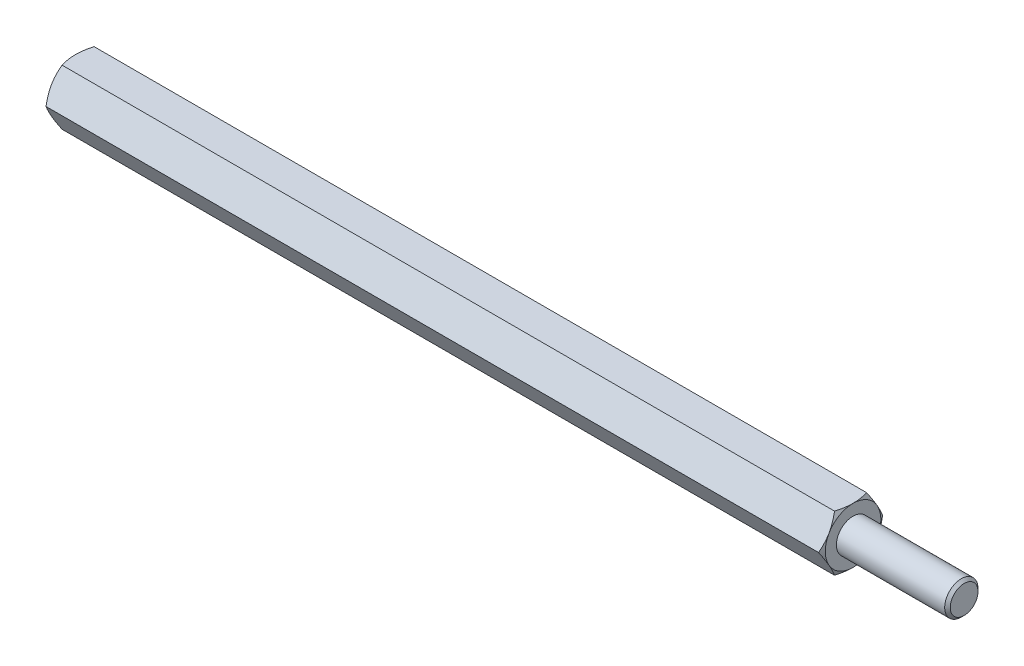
SolidWorks part; units mm, degrees
ref_plane "Front Plane" through (0, 0, 0) normal (0, 0, 1) x (1, 0, 0)
ref_plane "Top Plane" through (0, 0, 0) normal (0, 1, 0) x (1, 0, 0)
ref_plane "Right Plane" through (0, 0, 0) normal (1, 0, 0) x (0, 0, -1)
sketch "Sketch1" plane through (0, 0, 0) normal (1, 0, 0) x (0, 0, -1)
  line L1 (1.4434, 2.5) -> (-1.4434, 2.5)
  line L2 (-1.4434, 2.5) -> (-2.8868, 0)
  line L3 (-2.8868, 0) -> (-1.4434, -2.5)
  line L4 (-1.4434, -2.5) -> (1.4434, -2.5)
  line L5 (1.4434, -2.5) -> (2.8868, 0)
  line L6 (2.8868, 0) -> (1.4434, 2.5)
  circle A0 centre (0, 0) radius 2.5 construction
  dimension "D1" = 5
extrude "Extrude2" add sketch "Sketch1" along normal mid plane 70
sketch "Sketch2" plane through (0, 0, 0) normal (0, 0, 1) x (1, 0, 0)
  line L0 (-35, 2.5) -> (-33.5, 5.0981)
  line L1 (-35, 5.5) -> (-35, 2.5)
  line L3 (0, 0) -> (50000, 0) construction
  arc A0 (-33.5, 5.0981) -> (-35, 5.5) centre (-34.1962, 5.5) ccw
  dimension "D1" = 30
  dimension "D2" = 3
revolve "Cut-Revolve1" cut sketch "Sketch2" angle 360 about L3
mirror "Mirror1" about plane through (0, 0, 0) normal (1, 0, 0) of "Cut-Revolve1"
sketch "Sketch3" plane through (-35, 0, 0) normal (-1, 0, 0) x (0, 0, 1)
  circle A0 centre (0, 0) radius 1.25
  dimension "D1" = 2.5
extrude "Extrude3" cut sketch "Sketch3" against normal blind 10
sketch "Sketch4" plane through (0, 0, 0) normal (0, 0, 1) x (1, 0, 0)
  line L0 (-25, 0) -> (-25, 1.25)
  line L1 (34.7767, 0) -> (-34.7767, 0) construction
  line L2 (-25, 1.25) -> (-24.2783, 0)
  line L3 (-24.2783, 0) -> (-25, 0)
  line L4 (-35, 1.25) -> (-35, -1.25) construction
  point P4 (-35, 0)
  dimension "D1" = 30
  dimension "D2" = 1.25
  dimension "D3" = 10
revolve "Cut-Revolve2" cut sketch "Sketch4" angle 360 about L3
sketch "Sketch5" plane through (35, 0, 0) normal (1, 0, 0) x (0, 0, -1)
  circle A0 centre (0, 0) radius 1.5
  dimension "D1" = 3
extrude "Extrude4" add sketch "Sketch5" along normal blind 10
chamfer "Chamfer1" distance 0.25 angle 45 1 edges at (45, 0, -1.5)
equation "\"D2@Sketch4\" = \"D1@Sketch3\"/2"
